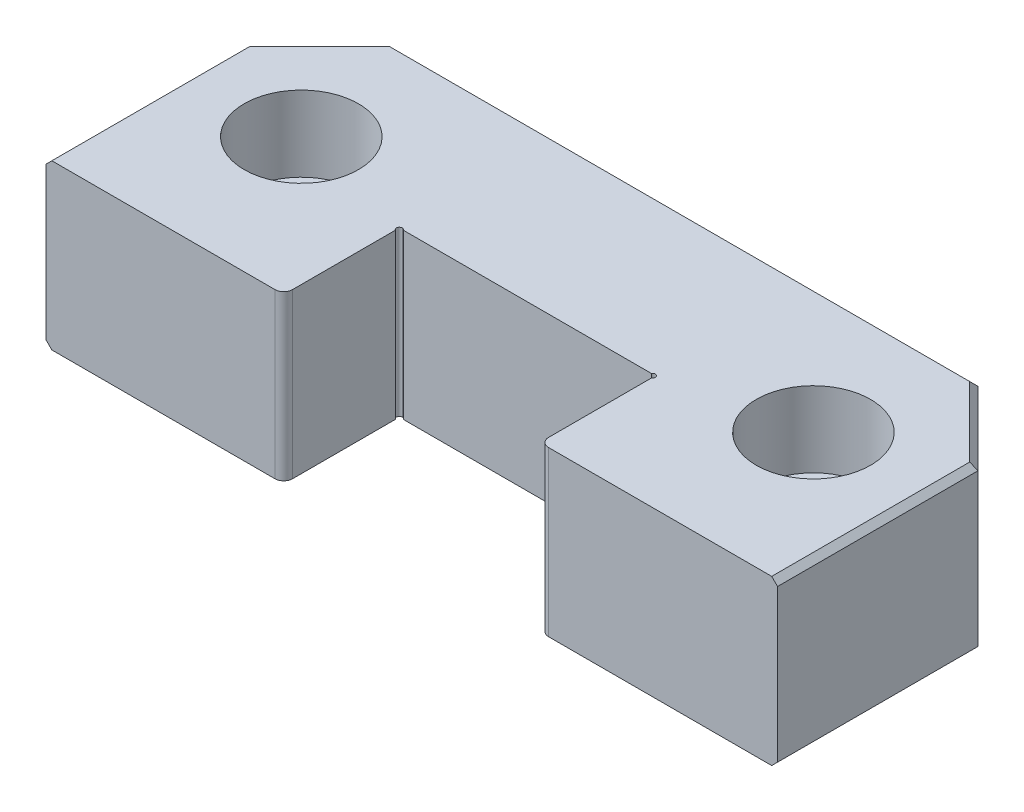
SolidWorks part; units mm, degrees
ref_plane "Front Plane" through (0, 0, 0) normal (0, 0, 1) x (1, 0, 0)
ref_plane "Top Plane" through (0, 0, 0) normal (0, 1, 0) x (1, 0, 0)
ref_plane "Right Plane" through (0, 0, 0) normal (1, 0, 0) x (0, 0, -1)
sketch "Sketch2" plane through (0, 0, 0) normal (0, 1, 0) x (1, 0, 0)
  line L0 (-55, 0) -> (55, 0) construction
  line L1 (-63.5, 47.498) -> (63.5, 47.498)
  line L2 (-63.5, 47.498) -> (-63.5, 0)
  line L3 (-63.5, 0) -> (63.5, 0)
  line L4 (63.5, 47.498) -> (63.5, 0)
  dimension "D1" = 127
  dimension "D2" = 47.498
  dimension "D3" = 63.5
extrude "Extrude1" add sketch "Sketch2" along normal blind 28.448
chamfer "Chamfer1" distance 12.7 angle 45 2 edges at (63.5, 14.224, -47.498) (-63.5, 14.224, -47.498)
sketch "Sketch3" plane through (0, 0, 0) normal (0, -1, 0) x (1, 0, 0)
  line L0 (15.6464, 0) -> (-15.6464, 0) construction
  line L1 (-21.5311, -20.066) -> (21.5311, -20.066)
  line L2 (-22.225, -19.3721) -> (-22.225, 1.5588)
  line L3 (-22.225, 1.5588) -> (22.225, 1.5588)
  line L4 (22.225, -19.3721) -> (22.225, 1.5588)
  line L5 (0, -15.6464) -> (0, 15.6464) construction
  arc A0 (-22.225, -19.3721) -> (-21.5311, -20.066) centre (-21.971, -19.812) ccw
  arc A1 (21.5311, -20.066) -> (22.225, -19.3721) centre (21.971, -19.812) ccw
  dimension "D4" = 0.254
  dimension "D5" = 0.254
  dimension "D6" = 1.016
  dimension "D7" = 1.016
  dimension "D1" = 44.45
  dimension "D2" = 20.066
  dimension "D3" = 22.225
  dimension "D8" = 0.254
  dimension "D9" = 0.254
extrude "Cut-Extrude1" cut sketch "Sketch3" along normal blind 22.86 and the other way through all
fillet "Fillet1" radius 1.524 2 edges at (-22.225, 14.224, 0) (22.225, 14.224, 0)
sketch "Sketch4" plane through (0, 0, 0) normal (0, -1, 0) x (1, 0, 0)
  line L1 (50.8, -47.498) -> (-50.8, -47.498) construction
  line L3 (-63.5, -34.798) -> (-63.5, 0) construction
  line L4 (63.5, 0) -> (63.5, -34.798) construction
  circle A0 centre (44.45, -25.273) radius 6.7437
  circle A1 centre (-44.45, -25.273) radius 6.7437
  dimension "D5" = 13.4874
  dimension "D6" = 13.4874
  dimension "D1" = 19.05
  dimension "D2" = 22.225
  dimension "D3" = 22.225
  dimension "D4" = 19.05
extrude "Cut-Extrude2" cut sketch "Sketch4" against normal blind 15.748
sketch "Sketch5" plane through (0, 0, 0) normal (0, -1, 0) x (1, 0, 0)
  circle A1 centre (44.45, -25.273) radius 9.9187
  circle A3 centre (-44.45, -25.273) radius 9.9187
  dimension "D1" = 19.8374
  dimension "D2" = 19.8374
extrude "Cut-Extrude3" cut sketch "Sketch5" along normal blind 13.1064 from surface at -28.448
chamfer "Chamfer2" distance 1.016 angle 45 10 edges at (-63.5, 28.448, -17.399) (-57.15, 28.448, -41.148) (0, 28.448, -47.498) (57.15, 28.448, -41.148) (63.5, 28.448, -17.399) (63.5, 0, -17.399) (57.15, 0, -41.148) (0, 0, -47.498) (-57.15, 0, -41.148) (-63.5, 0, -17.399)
